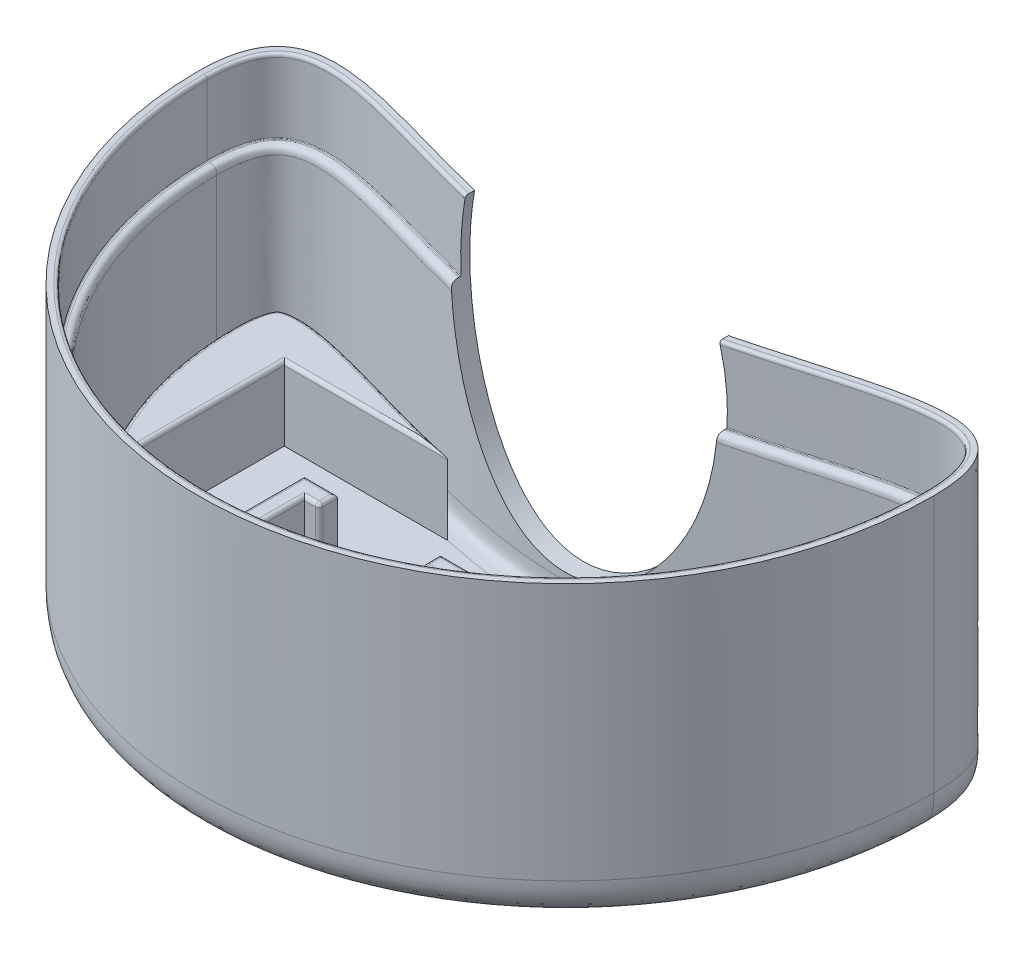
SolidWorks part; units mm, degrees
ref_plane "Front Plane" through (0, 0, 0) normal (0, 0, 1) x (1, 0, 0)
ref_plane "Top Plane" through (0, 0, 0) normal (0, 1, 0) x (1, 0, 0)
ref_plane "Right Plane" through (0, 0, 0) normal (1, 0, 0) x (0, 0, -1)
imported_body "Stock-case 2 coffee-1"
fillet "Fillet1" radius 0.5 50 edges at (-5.463, 12.5, 39.7782) (-7.7144, 12.5, 33.816) (-5.463, 12.5, 27.8539) (-3.2116, 12.5, 38.5282) (-3.2116, 27.5, 38.5282) (-3.2116, 20, 37.2782) (-4.213, 27.5, 37.2782) (-5.2144, 27.5, 33.816) (-4.213, 27.5, 30.3539) (-3.2116, 20, 30.3539) (-3.2116, 12.5, 29.1039) (-3.2116, 27.5, 29.1039) (-5.463, 27.5, 27.8539) (-7.7144, 27.5, 33.816) (-5.463, 27.5, 39.7782) (3.7884, 12.5, 30.3539) (3.7884, 12.5, 37.2782) (13.0398, 12.5, 27.8539) (15.2912, 12.5, 33.816) (13.0398, 12.5, 39.7782) (10.7884, 12.5, 38.5282) (10.7884, 12.5, 29.1039) (11.7898, 27.5, 37.2782) (10.7884, 20, 37.2782) (10.7884, 20, 30.3539) (11.7898, 27.5, 30.3539) (12.7912, 27.5, 33.816) (10.7884, 27.5, 38.5282) (13.0398, 27.5, 39.7782) (15.2912, 27.5, 33.816) (13.0398, 27.5, 27.8539) (10.7884, 27.5, 29.1039)
